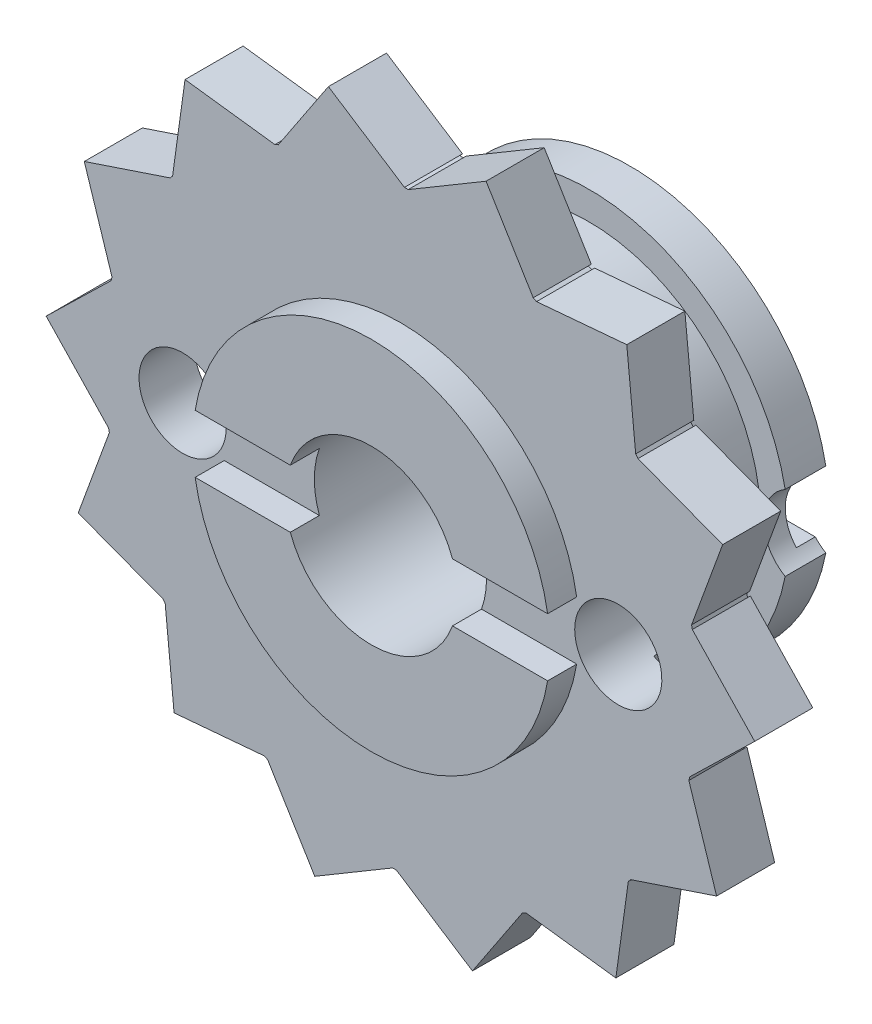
SolidWorks part; units mm, degrees
ref_plane "Plan de face" through (0, 0, 0) normal (0, 0, 1) x (1, 0, 0)
ref_plane "Plan de dessus" through (0, 0, 0) normal (0, 1, 0) x (1, 0, 0)
ref_plane "Plan de droite" through (0, 0, 0) normal (1, 0, 0) x (0, 0, -1)
sketch "Esquisse1" plane through (0, 0, 0) normal (0, 0, 1) x (1, 0, 0)
  circle A0 centre (0, 0) radius 10.25
  dimension "D1" = 20.5
extrude "Extrusion1" add sketch "Esquisse1" along normal blind 8.9
sketch "Esquisse2" plane through (0, 0, 8.9) normal (0, 0, 1) x (1, 0, 0)
  line L0 (-9.3397, 0) -> (9.3791, 0) construction
  line L1 (9.3791, 2.4433) -> (9.3791, -3.0738) construction
  line L2 (-9.3397, 2.995) -> (-9.3397, -2.5615) construction
  line L3 (-6.15, 0) -> (-6.15, 2.995) construction
  line L4 (6.15, 0) -> (6.15, 2) construction
  line L5 (-6.15, 1) -> (6.15, 1)
  line L6 (-6.15, -1) -> (6.15, -1)
  circle A0 centre (0, 0) radius 6.15
  circle A1 centre (0, 0) radius 2.96
  dimension "D1" = 12.3
  dimension "D2" = 5.92
  dimension "D3" = 1
extrude "Enlèv. mat.-Extru.2" cut sketch "Esquisse2" against normal blind 1
sketch "Esquisse4" plane through (0, 0, 7.9) normal (0, 0, 1) x (1, 0, 0)
  circle A0 centre (0, 0) radius 12.2
  dimension "D1" = 24.4
extrude "Extrusion2" add sketch "Esquisse4" against normal blind 2
sketch "Esquisse3" plane through (0, 0, 8.9) normal (0, 0, 1) x (1, 0, 0)
  circle A0 centre (0, 0) radius 2.965
  dimension "D1" = 5.93
extrude "Enlèv. mat.-Extru.3" cut sketch "Esquisse3" against normal through all
sketch "Esquisse6" plane through (0, 0, 5.9) normal (0, 0, -1) x (-1, 0, 0)
  line L0 (-2.9491, 11.8382) -> (0, 0) construction
  line L1 (-0.2409, 12.1976) -> (0, 0) construction
  line L2 (0, 0) -> (2.4793, 11.9454) construction
  line L3 (4.613, 22.2254) -> (-0.437, 22.1257) construction
  line L4 (-0.437, 22.1257) -> (-5.4871, 22.0259) construction
  line L5 (-0.2409, 12.1976) -> (0, 0)
  line L6 (2.4793, 11.9454) -> (-0.2016, 10.208)
  line L7 (-0.2016, 10.208) -> (-2.9491, 11.8382)
  line L8 (-4.6108, 9.1096) -> (-2.9491, 11.8382)
  line L9 (-7.7935, 9.3863) -> (-4.6108, 9.1096)
  line L10 (0, 0) -> (-7.7935, 9.3863) construction
  line L11 (-8.1067, 6.2069) -> (-11.0942, 5.0753)
  line L12 (-7.7935, 9.3863) -> (-8.1067, 6.2069)
  line L13 (4.2474, 9.2846) -> (7.4167, 9.6867)
  line L14 (2.4793, 11.9454) -> (4.2474, 9.2846)
  line L15 (-11.0942, 5.0753) -> (0, 0) construction
  line L16 (0, 0) -> (7.4167, 9.6867) construction
  line L17 (-9.9969, 2.0749) -> (-11.0942, 5.0753)
  line L18 (-12.1976, -0.2409) -> (-9.9969, 2.0749)
  line L19 (10.8851, 5.5094) -> (7.8552, 6.5222)
  line L20 (7.8552, 6.5222) -> (7.4167, 9.6867)
  line L21 (10.8851, 5.5094) -> (0, 0) construction
  line L22 (9.9072, 2.4681) -> (12.1976, 0.2409)
  line L23 (10.8851, 5.5094) -> (9.9072, 2.4681)
  line L24 (12.1976, 0.2409) -> (-12.1976, -0.2409) construction
  line L25 (9.9969, -2.0749) -> (12.1976, 0.2409)
  line L26 (11.0942, -5.0753) -> (9.9969, -2.0749)
  line L27 (11.0942, -5.0753) -> (8.1067, -6.2069)
  line L28 (8.1067, -6.2069) -> (7.7935, -9.3863)
  line L29 (4.6108, -9.1096) -> (7.7935, -9.3863)
  line L30 (2.9491, -11.8382) -> (0.2016, -10.208)
  line L31 (2.9491, -11.8382) -> (4.6108, -9.1096)
  line L32 (-12.1976, -0.2409) -> (-9.9072, -2.4681)
  line L33 (-9.9072, -2.4681) -> (-10.8851, -5.5094)
  line L34 (-7.8552, -6.5222) -> (-10.8851, -5.5094)
  line L35 (-7.4167, -9.6867) -> (-4.2474, -9.2846)
  line L36 (-7.4167, -9.6867) -> (-7.8552, -6.5222)
  line L37 (-4.2474, -9.2846) -> (-2.4793, -11.9454)
  line L38 (0.2016, -10.208) -> (-2.4793, -11.9454)
  circle A0 centre (0, 0) radius 12.2
  arc A1 (-2.9491, 11.8382) -> (-7.7935, 9.3863) centre (-4.6108, 9.1096) ccw
  circle A2 centre (0, 0) radius 10.21
  arc A3 (2.4793, 11.9454) -> (-2.9491, 11.8382) centre (-0.2016, 10.208) ccw
  circle A4 centre (0, 0) radius 12.2 construction
  arc A5 (-7.7935, 9.3863) -> (-11.0942, 5.0753) centre (-8.1067, 6.2069) ccw
  arc A6 (-11.0942, 5.0753) -> (-12.1976, -0.2409) centre (-9.9969, 2.0749) ccw
  arc A7 (12.1976, 0.2409) -> (10.8851, 5.5094) centre (9.9072, 2.4681) ccw
  arc A8 (10.8851, 5.5094) -> (7.4167, 9.6867) centre (7.8552, 6.5222) ccw
  arc A9 (7.4167, 9.6867) -> (2.4793, 11.9454) centre (4.2474, 9.2846) ccw
  arc A10 (12.1976, 0.2409) -> (11.0942, -5.0753) centre (9.9969, -2.0749) cw
  arc A11 (11.0942, -5.0753) -> (7.7935, -9.3863) centre (8.1067, -6.2069) cw
  arc A12 (2.9491, -11.8382) -> (-2.4793, -11.9454) centre (0.2016, -10.208) cw
  arc A13 (-2.4793, -11.9454) -> (-7.4167, -9.6867) centre (-4.2474, -9.2846) cw
  arc A14 (-7.4167, -9.6867) -> (-10.8851, -5.5094) centre (-7.8552, -6.5222) cw
  arc A15 (-10.8851, -5.5094) -> (-12.1976, -0.2409) centre (-9.9072, -2.4681) cw
  arc A16 (7.7935, -9.3863) -> (2.9491, -11.8382) centre (4.6108, -9.1096) cw
  dimension "D1" = 20.42
  dimension "D4" = 24.4
  dimension "D2" = 25.714
  dimension "D3" = 12.1976
extrude "Enlèv. mat.-Extru.4" cut sketch "Esquisse6" against normal blind 10
sketch "Esquisse7" plane through (0, 0, 0) normal (0, 0, -1) x (-1, 0, 0)
  circle A0 centre (0, 0) radius 6.87
  circle A1 centre (0, 0) radius 10.25
  dimension "D1" = 13.74
  dimension "D2" = 20.5
extrude "Enlèv. mat.-Extru.5" cut sketch "Esquisse7" against normal blind 1.4
sketch "Esquisse8" plane through (0, 0, 1.4) normal (0, 0, -1) x (-1, 0, 0)
  circle A0 centre (0, 0) radius 5.9
  circle A1 centre (0, 0) radius 10.25
  dimension "D1" = 11.8
  dimension "D2" = 20.5
extrude "Enlèv. mat.-Extru.7" cut sketch "Esquisse8" against normal blind 3.15
sketch "Esquisse9" plane through (0, 0, 4.55) normal (0, 0, -1) x (-1, 0, 0)
  circle A0 centre (0, 0) radius 6.95
  circle A1 centre (0, 0) radius 10.25
  dimension "D1" = 13.9
  dimension "D2" = 20.5
extrude "Enlèv. mat.-Extru.8" cut sketch "Esquisse9" against normal blind 1.45
sketch "Esquisse10" plane through (0, 0, 0) normal (0, 0, -1) x (-1, 0, 0)
  line L0 (-6.87, 0) -> (6.87, 0) construction
  line L2 (-6.87, 0) -> (6.7968, 0)
  line L3 (-6.87, 0) -> (-6.87, 1)
  line L4 (-6.87, 1) -> (6.7968, 1)
  line L5 (6.7968, 0) -> (6.7968, 1)
  line L6 (-6.87, 0) -> (6.7968, 0)
  line L7 (-6.87, 0) -> (-6.87, -1)
  line L8 (-6.87, -1) -> (6.7968, -1)
  line L9 (6.7968, 0) -> (6.7968, -1)
  circle A0 centre (0, 0) radius 6.87 construction
  circle A1 centre (0, 0) radius 2.965
  dimension "D3" = 5.93
  dimension "D1" = 1
  dimension "D2" = 1
extrude "Enlèv. mat.-Extru.10" cut sketch "Esquisse10" against normal blind 0.65
sketch "Esquisse12" plane through (0, 0, 0) normal (1, 0, 0) x (0, 0, -1)
  line L0 (-2.975, -5.9) -> (-2.975, 5.9)
  line L1 (-1.4, -5.9) -> (-4.55, -5.9)
  line L2 (-1.4, -5.9) -> (-1.4, 5.9)
  line L3 (-1.4, 5.9) -> (-4.55, 5.9)
  line L4 (-4.55, -5.9) -> (-4.55, 5.9)
  line L5 (-1.4, 0) -> (-4.55, 0)
  circle A0 centre (-2.975, 0) radius 1.15
  dimension "D1" = 2.3
extrude "Enlèv. mat.-Extru.11" cut sketch "Esquisse12" against normal through all and the other way through all
sketch "Esquisse13" plane through (0, 0, 7.9) normal (0, 0, 1) x (1, 0, 0)
  line L0 (-9.6346, 0) -> (9.0167, 0) construction
  line L1 (0, 7.3947) -> (0, -7.1633) construction
  circle A0 centre (-7.5, 0) radius 1.5
  circle A1 centre (7.5, 0) radius 1.5
  dimension "D2" = 3
  dimension "D1" = 7.5
extrude "Enlèv. mat.-Extru.12" cut sketch "Esquisse13" against normal blind 10
